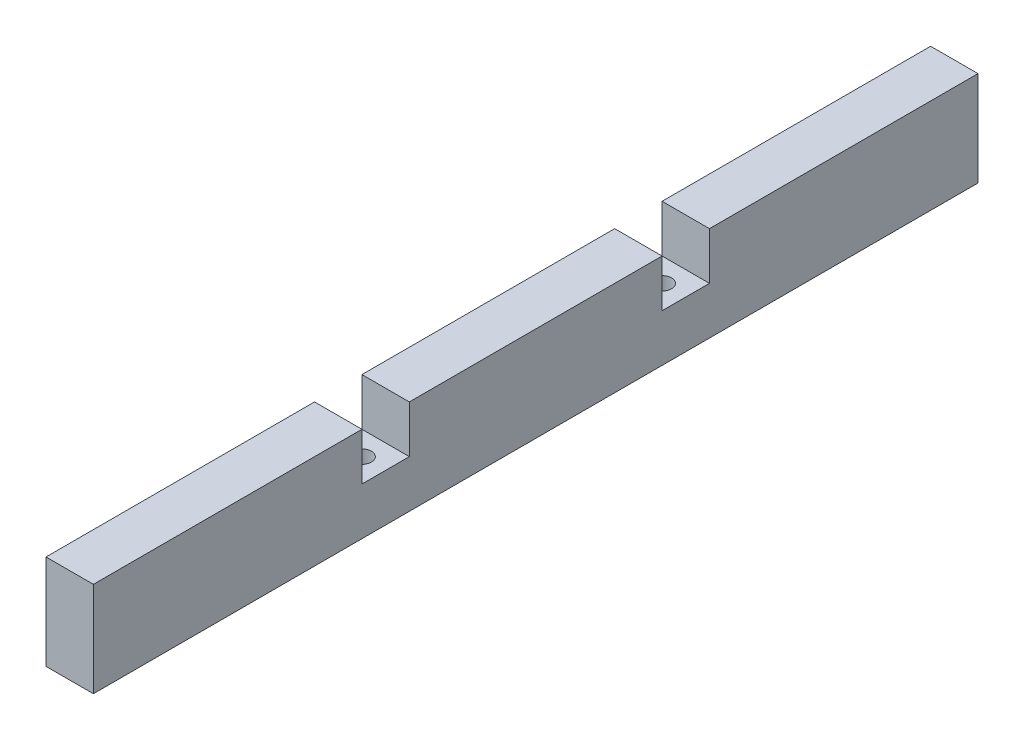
SolidWorks part; units mm, degrees
ref_plane "Plan de face" through (0, 0, 0) normal (0, 0, 1) x (1, 0, 0)
ref_plane "Plan de dessus" through (0, 0, 0) normal (0, 1, 0) x (1, 0, 0)
ref_plane "Plan de droite" through (0, 0, 0) normal (1, 0, 0) x (0, 0, -1)
sketch "Esquisse1" plane through (0, 0, 0) normal (0, 0, 1) x (1, 0, 0)
  line L1 (0, 0) -> (-15, 0)
  line L2 (0, 0) -> (0, 30)
  line L3 (0, 30) -> (-15, 30)
  line L4 (-15, 0) -> (-15, 30)
  dimension "D1" = 15
  dimension "D2" = 30
extrude "Boss.-Extru.1" add sketch "Esquisse1" along normal mid plane 280
sketch "Esquisse2" plane through (0, 0, 0) normal (1, 0, 0) x (0, 0, -1)
  line L0 (-140, 30) -> (140, 30) construction
  line L1 (55, 30) -> (40, 30)
  line L2 (55, 30) -> (55, 15)
  line L3 (55, 15) -> (40, 15)
  line L4 (40, 30) -> (40, 15)
  dimension "D1" = 15
  dimension "D2" = 15
  dimension "D3" = 40
extrude "Enlèv. mat.-Extru.1" cut sketch "Esquisse2" against normal through all
sketch "Esquisse3" plane through (0, 15, 0) normal (0, 1, 0) x (1, 0, 0)
  line L0 (-15, 55) -> (0, 55) construction
  line L1 (0, 40) -> (0, 55) construction
  circle A0 centre (-7.5, 47.5) radius 3
  dimension "D3" = 6
  dimension "D1" = 7.5
  dimension "D2" = 7.5
extrude "Enlèv. mat.-Extru.2" cut sketch "Esquisse3" against normal through all
pattern_linear "Répétition linéaire1" [suppressed] count 2 spacing 50
mirror "Symétrie1" about plane through (0, 0, 0) normal (0, 0, 1) of "Enlèv. mat.-Extru.2", "Enlèv. mat.-Extru.1"
